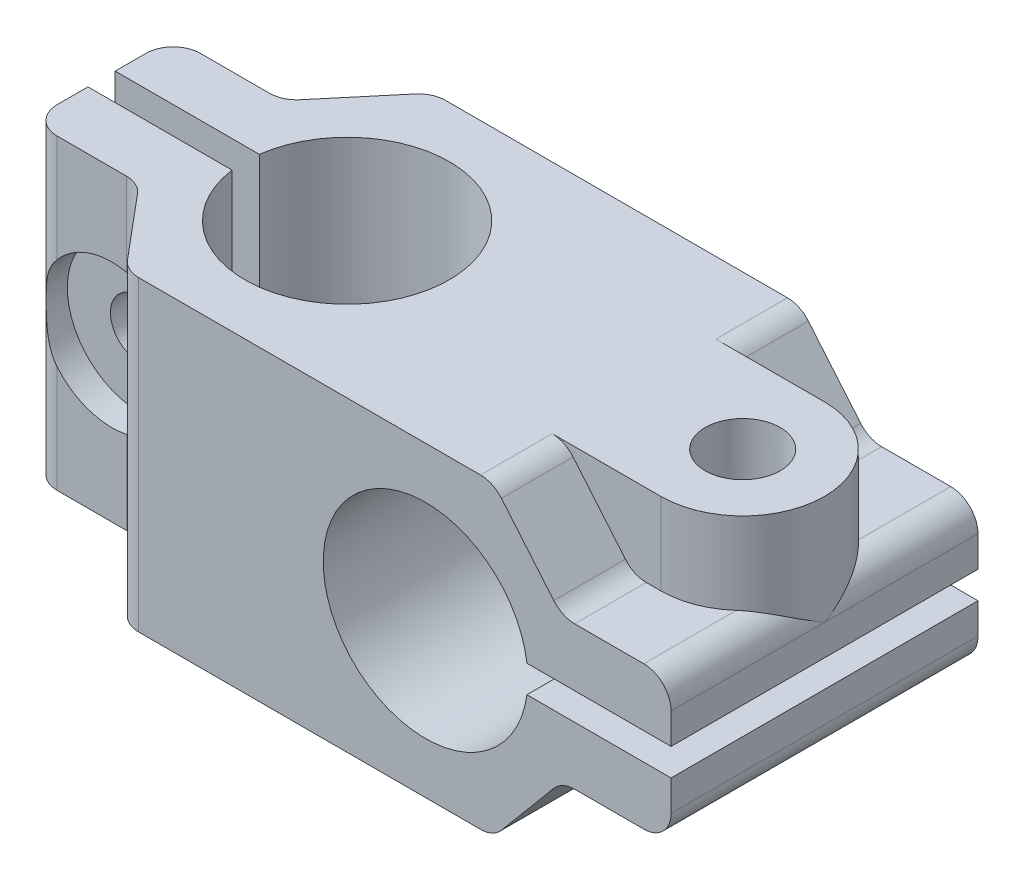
SolidWorks part; units mm, degrees
ref_plane "Front Plane" through (0, 0, 0) normal (0, 0, 1) x (1, 0, 0)
ref_plane "Top Plane" through (0, 0, 0) normal (0, 1, 0) x (1, 0, 0)
ref_plane "Right Plane" through (0, 0, 0) normal (1, 0, 0) x (0, 0, -1)
other "Configuration Table"
sketch "Sketch1" plane through (0, 0, 0) normal (0, 1, 0) x (1, 0, 0)
  line L0 (-26.5, -11.25) -> (26.5, 11.25) construction
  line L1 (0, 11.25) -> (26.5, 11.25)
  line L2 (-26.5, 12.5151) -> (-26.5, -11.25) construction
  line L3 (0, -11.25) -> (26.5, -11.25)
  line L4 (26.5, 11.25) -> (26.5, -11.25)
  line L5 (0, 11.25) -> (0, -11.25)
  dimension "D1" = 22.5
  dimension "D2" = 53
extrude "Extrude1" add sketch "Sketch1" along normal mid plane 22.5
sketch "Sketch4" plane through (0, 0, 11.25) normal (0, 0, 1) x (1, 0, 0)
  line L2 (13.4654, 11.25) -> (18.5, 5.25)
  line L3 (18.5, 5.25) -> (26.5, 5.25)
  line L4 (26.5, 11.25) -> (26.5, -11.25) construction
  line L5 (26.5, 11.25) -> (26.5, 5.25)
  line L7 (0, 11.25) -> (26.5, 11.25) construction
  line L8 (13.4654, 11.25) -> (26.5, 11.25)
  dimension "D1" = 8
  dimension "D2" = 130
  dimension "D3" = 6
extrude "Cut-Extrude3" cut sketch "Sketch4" against normal through all
mirror "Mirror1" about plane through (0, 0, 0) normal (0, 1, 0) of "Cut-Extrude3"
fillet "Fillet4" radius 2 6 edges at (26.5, 5.25, 0) (18.5, 5.25, 0) (13.4654, 11.25, 0) (26.5, -5.25, 0) (18.5, -5.25, 0) (13.4654, -11.25, 0)
sketch "Sketch6" plane through (0, 11.25, 0) normal (0, 1, 0) x (-1, 0, 0)
  line L0 (-26.5, -11.25) -> (-26.5, 11.25) construction
  line L1 (-20.5, -6) -> (0, -6)
  line L2 (0, -6) -> (0, 6)
  line L3 (0, 6) -> (-20.5, 6)
  line L5 (0, -11.25) -> (0, 11.25) construction
  arc A0 (-20.5, 6) -> (-20.5, -6) centre (-20.5, 0) ccw
  dimension "D1" = 6
extrude "Extrude2" add sketch "Sketch6" against normal up to next
sketch "Sketch2" plane through (0, 0, 11.25) normal (0, 0, 1) x (1, 0, 0)
  line L1 (12.375, 0) -> (-12.375, 0) construction
  line L2 (15.933, 1) -> (26.5, 1)
  line L3 (26.5, 3.25) -> (26.5, -3.25) construction
  line L4 (15.933, -1) -> (26.5, -1)
  arc A0 (15.933, 1) -> (15.933, -1) centre (8.5, 0) ccw
  dimension "D2" = 15
  dimension "D1" = 35
  dimension "D3" = 2
extrude "Cut-Extrude4" cut sketch "Sketch2" against normal through all and the other way through all
hole_wizard "M5 Clearance Hole1"
sketch "Sketch10"
  arc A0 (-20.5, 6) -> (-20.5, -6) centre (-20.5, 0) ccw construction
  point P0 (-20.5, 0)
move or copy body "Body-Move/Copy1"
sketch "Sketch9" plane through (20.5, 11.25, 0) normal (1, 0, 0) x (0, 0, 1)
  line L0 (0, 0) -> (0, 10.25)
  line L1 (0, 10.25) -> (2.75, 10.25)
  line L2 (2.75, 10.25) -> (2.75, 0)
  line L5 (2.75, 0) -> (0, 0)
  line L11 (0, -6.35) -> (0, 107.95) construction
  dimension "Thru Hole Dia." = 5.5
  dimension "Thru Hole Depth" = 10.25
hole_wizard "M5x0.8 Tapped Hole1" positions "Sketch12" profile "Sketch11" tap size "M5x0.8" standard "Ansi Metric"
sketch "Sketch12" plane through (0, -1, 0) normal (0, 1, 0) x (-1, 0, 0)
  circle A0 centre (-20.5, 0) radius 2.75 construction
  point P0 (-20.5, 0)
sketch "Sketch11" plane through (20.5, -1, 0) normal (1, 0, 0) x (0, 0, 1)
  line L0 (0, 0) -> (0, 13.6618)
  line L1 (0, 13.6618) -> (2.1, 12.4)
  line L2 (2.1, 12.4) -> (2.1, 0)
  line L5 (2.1, 0) -> (0, 0)
  line L10 (0, 13.6618) -> (-2.1, 12.4) construction
  line L11 (0, -6.35) -> (0, 107.95) construction
  dimension "Tap Drill Dia." = 4.2
  dimension "Tap Drill Depth" = 12.4
  dimension "Drill Angle" = 118
sketch "Sketch13" plane through (0, -5.25, 0) normal (0, -1, 0) x (1, 0, 0)
  circle A0 centre (20.5, 0) radius 5.2605
  arc A1 (20.5, -6) -> (20.5, 6) centre (20.5, 0) ccw construction
extrude "Cut-Extrude5" cut sketch "Sketch13" against normal blind 2 and the other way through all
combine bodies "Combine1" operation type add bodies to combine 108 114
